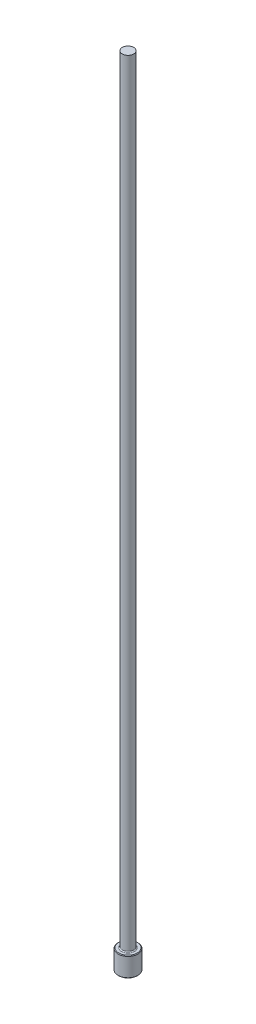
SolidWorks part; units mm, degrees
ref_plane "Front Plane" through (0, 0, 0) normal (0, 0, 1) x (1, 0, 0)
ref_plane "Top Plane" through (0, 0, 0) normal (0, 1, 0) x (1, 0, 0)
ref_plane "Right Plane" through (0, 0, 0) normal (1, 0, 0) x (0, 0, -1)
other "Configuration Table"
sketch "Sketch1" plane through (0, 0, 0) normal (0, 0, 1) x (1, 0, 0)
  line L0 (0, 259.9588) -> (0, -15.1925) construction
  line L1 (0, 0) -> (-0.7874, 0)
  line L2 (-0.7874, 0) -> (-0.7874, 1.5748)
  line L3 (-0.7874, 1.5748) -> (-0.4572, 1.5748)
  line L4 (-0.4572, 1.5748) -> (-0.4572, 63.5)
  line L5 (-0.4572, 63.5) -> (0, 63.5)
  line L6 (0, 63.5) -> (0, 0)
  dimension "L" = 63.5
  dimension "H" = 1.5748
  dimension "T" = 1.5748
  dimension "D" = 0.9144
revolve "Revolve1" add sketch "Sketch1" angle 360 about L0
chamfer "Chamfer1" distance 0.0508 angle 45 2 edges at (0, 1.5748, 0.7874) (0, 0, 0.7874)
fillet "Fillet1" radius 0.0762 1 edges at (0, 1.5748, 0.4572)
